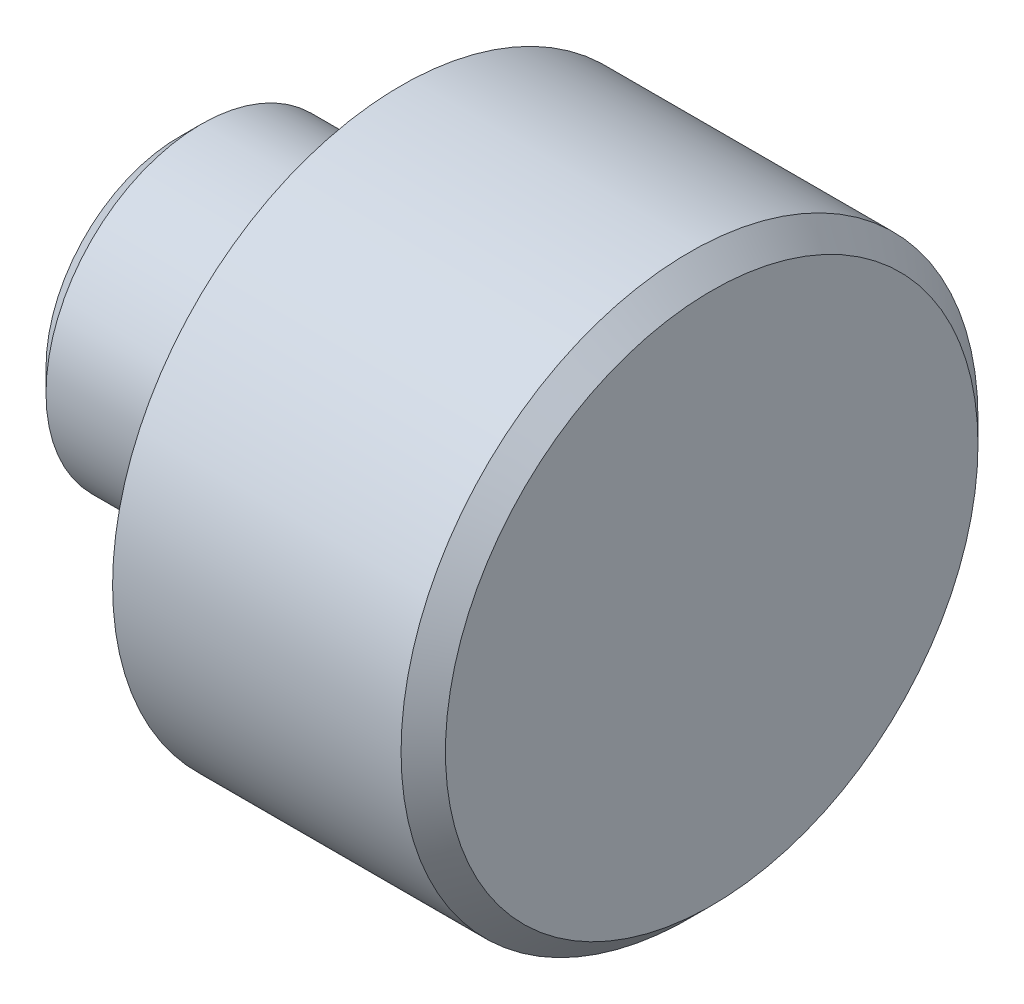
SolidWorks part; units mm, degrees
ref_plane "Face" through (0, 0, 0) normal (0, 0, 1) x (1, 0, 0)
ref_plane "Dessus" through (0, 0, 0) normal (0, 1, 0) x (1, 0, 0)
ref_plane "Droite" through (0, 0, 0) normal (1, 0, 0) x (0, 0, -1)
sketch "Esquisse1" plane through (0, 0, 0) normal (1, 0, 0) x (0, 0, -1)
  circle A0 centre (0, 0) radius 6.5
  dimension "D1" = 13
extrude "Base-Extrusion" add sketch "Esquisse1" along normal blind 7
sketch "Esquisse2" plane through (0, 0, 0) normal (-1, 0, 0) x (0, 0, 1)
  circle A0 centre (0, 0) radius 3.5
  dimension "D1" = 7
extrude "Boss.-Extru.1" add sketch "Esquisse2" along normal blind 5
chamfer "Chanfrein1" distance 0.5 angle 45 2 edges at (7, 0, -6.5) (-5, 0, 3.5)
